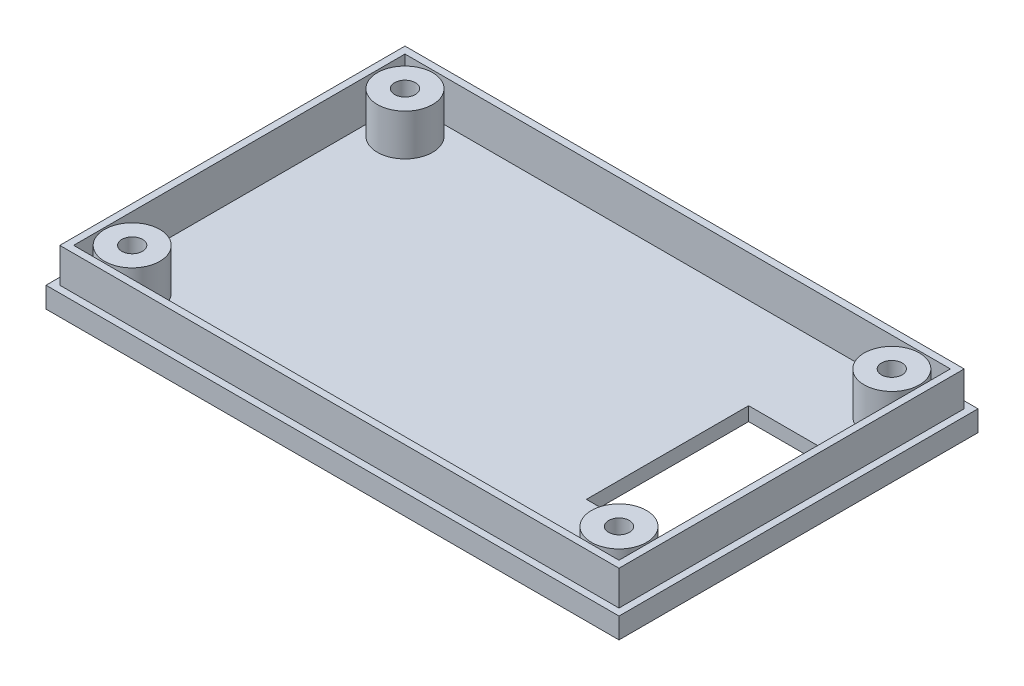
SolidWorks part; units mm, degrees
ref_plane "Front Plane" through (0, 0, 0) normal (0, 0, 1) x (1, 0, 0)
ref_plane "Top Plane" through (0, 0, 0) normal (0, 1, 0) x (1, 0, 0)
ref_plane "Right Plane" through (0, 0, 0) normal (1, 0, 0) x (0, 0, -1)
sketch "Sketch2" plane through (0, 0, 0) normal (0, 1, 0) x (1, 0, 0)
  line L0 (-15.9414, -25.7613) -> (67.0586, -25.7613)
  line L1 (67.0586, -25.7613) -> (67.0586, 26.2387)
  line L2 (67.0586, 26.2387) -> (-15.9414, 26.2387)
  line L3 (-15.9414, 26.2387) -> (-15.9414, -25.7613)
extrude "Boss-Extrude1" add sketch "Sketch2" along normal blind 2
sketch "Sketch3" plane through (0, 2, 0) normal (0, 1, 0) x (1, 0, 0)
  line L0 (-15.9414, 26.2387) -> (-13.9414, 26.2387)
  line L1 (-15.9414, 26.2387) -> (67.0586, 26.2387)
  line L2 (-15.9414, 26.2387) -> (-15.9414, -25.7613)
  line L3 (-15.9414, -25.7613) -> (67.0586, -25.7613)
  line L4 (67.0586, 26.2387) -> (67.0586, -25.7613)
  line L6 (67.0586, -25.7613) -> (67.0586, -23.7613)
  line L9 (-13.9414, 24.2387) -> (65.0586, 24.2387)
  line L10 (-13.9414, 24.2387) -> (-13.9414, -23.7613)
  line L11 (-13.9414, -23.7613) -> (65.0586, -23.7613)
  line L12 (65.0586, 24.2387) -> (65.0586, -23.7613)
  point P6 (0, 0)
  point P13 (0, 0)
sketch "Sketch4" plane through (0, 2, 0) normal (0, 1, 0) x (1, 0, 0)
  line L1 (-15.9414, 26.2387) -> (67.0586, 26.2387)
  line L2 (-15.9414, 26.2387) -> (-15.9414, -25.7613)
  line L3 (-15.9414, -25.7613) -> (67.0586, -25.7613)
  line L4 (67.0586, 26.2387) -> (67.0586, -25.7613)
  line L5 (-13.9414, 24.2387) -> (65.0586, 24.2387)
  line L6 (-13.9414, 24.2387) -> (-13.9414, -23.7613)
  line L7 (-13.9414, -23.7613) -> (65.0586, -23.7613)
  line L8 (65.0586, 24.2387) -> (65.0586, -23.7613)
extrude "Boss-Extrude5" add sketch "Sketch4" along normal blind 20
sketch "Sketch5" plane through (0, 22, 0) normal (0, 1, 0) x (1, 0, 0)
  line L7 (-14.9414, 25.2387) -> (66.0586, 25.2387)
  line L8 (-14.9414, 25.2387) -> (-14.9414, -24.7613)
  line L9 (-14.9414, -24.7613) -> (66.0586, -24.7613)
  line L10 (66.0586, 25.2387) -> (66.0586, -24.7613)
extrude "Cut-Extrude1" cut sketch "Sketch5" against normal blind 5
sketch "Sketch10" plane through (0, 2, 0) normal (0, 1, 0) x (1, 0, 0)
  circle A0 centre (-9.6047, 19.9019) radius 4
extrude "Boss-Extrude31" add sketch "Sketch10" along normal blind 14.5 contours A0
sketch "Sketch11" plane through (0, 2, 0) normal (0, 1, 0) x (1, 0, 0)
  circle A0 centre (-9.6988, -19.5187) radius 4
  circle A1 centre (60.8159, -19.5187) radius 4
  circle A2 centre (60.8159, 19.996) radius 4
extrude "Boss-Extrude32" add sketch "Sketch11" along normal blind 14.5
sketch "Sketch12" plane through (0, 16.5, 0) normal (0, 1, 0) x (1, 0, 0)
  circle A0 centre (-9.6988, 19.996) radius 1.5
  circle A1 centre (-9.6988, -19.5187) radius 1.5
  circle A2 centre (60.8159, -19.5187) radius 1.5
  circle A3 centre (60.8159, 19.996) radius 1.5
extrude "Cut-Extrude3" cut sketch "Sketch12" against normal blind 20
sketch "Sketch13" plane through (0, 0, 0) normal (0, -1, 0) x (1, 0, 0)
  circle A0 centre (-9.6988, 19.5187) radius 2.5
  circle A1 centre (60.8159, 19.5187) radius 2.5
  circle A2 centre (60.8159, -19.996) radius 2.5
  circle A3 centre (-9.6988, -19.996) radius 2.5
extrude "Cut-Extrude4" cut sketch "Sketch13" against normal blind 14.5
sketch "Sketch17" plane through (0, 22, 0) normal (0, 1, 0) x (1, 0, 0)
  line L1 (-15.9414, 26.2387) -> (67.0586, 26.2387)
  line L2 (-15.9414, 26.2387) -> (-15.9414, -25.7613)
  line L3 (-15.9414, -25.7613) -> (67.0586, -25.7613)
  line L4 (67.0586, 26.2387) -> (67.0586, -25.7613)
extrude "Cut-Extrude8" cut sketch "Sketch17" against normal blind 14
sketch "Sketch18" plane through (0, 8, 0) normal (0, 1, 0) x (1, 0, 0)
  circle A0 centre (-9.9154, 20.1291) radius 3.3387
  circle A1 centre (-9.6988, -19.5187) radius 3.1227
  circle A2 centre (60.8159, -19.5187) radius 3.1225
  circle A3 centre (60.8159, 19.996) radius 2.9018
extrude "Boss-Extrude34" add sketch "Sketch18" against normal blind 8
sketch "Sketch19" plane through (0, 8, 0) normal (0, 1, 0) x (1, 0, 0)
  line L1 (-13.9414, 25.2387) -> (-14.9414, 25.2387)
  line L2 (-15.9414, 26.2387) -> (67.0586, 26.2387)
  line L3 (66.0586, -23.7613) -> (66.0586, -24.7656)
  line L4 (-15.9414, 26.2387) -> (-15.9414, -25.7613)
  line L5 (66.0586, -24.7656) -> (-14.9414, -24.7656)
  line L6 (66.0586, -24.7656) -> (66.0586, 25.2387)
  line L7 (66.0586, 25.2387) -> (-14.9414, 25.2387)
  line L8 (-14.9414, -24.7656) -> (-14.9414, 25.2387)
  line L9 (-15.9414, -25.7613) -> (67.0586, -25.7613)
  line L10 (67.0586, 26.2387) -> (67.0586, -25.7613)
extrude "Cut-Extrude9" cut sketch "Sketch19" against normal blind 5 contours L5 L8 L1 L7 L6 L3 M16 M13 M14 M15
sketch "Sketch20" plane through (0, 0, 0) normal (0, -1, 0) x (1, 0, 0)
  line L1 (49.0586, 12.4869) -> (62.0586, 12.4869)
  line L2 (49.0586, 12.4869) -> (49.0586, -11.0131)
  line L3 (49.0586, -11.0131) -> (62.0586, -11.0131)
  line L4 (62.0586, 12.4869) -> (62.0586, -11.0131)
  line L5 (67.0586, 25.7613) -> (67.0586, -26.2387) construction
  dimension "D1" = 5
  dimension "D2" = 13
  dimension "D3" = 23.5
extrude "Cut-Extrude10" cut sketch "Sketch20" against normal blind 5
sketch "Sketch21" plane through (0, 8, 0) normal (0, 1, 0) x (1, 0, 0)
  circle A0 centre (60.8159, -19.5187) radius 1.5
  circle A1 centre (60.8159, 19.996) radius 1.5
  circle A2 centre (-9.6047, 19.9019) radius 1.5
  circle A3 centre (-9.6988, -19.5187) radius 1.5
  dimension "D1" = 3
extrude "Cut-Extrude11" cut sketch "Sketch21" against normal blind 3
